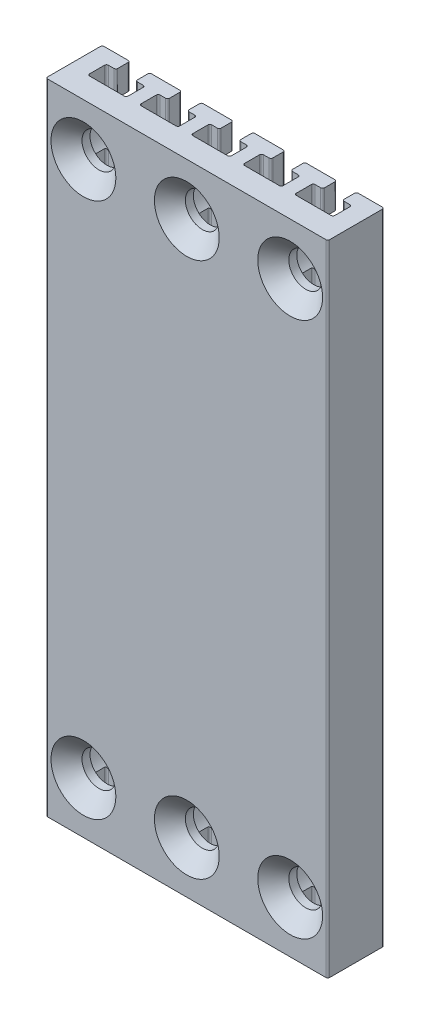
SolidWorks part; units mm, degrees
ref_plane "Plan de face" through (0, 0, 0) normal (0, 0, 1) x (1, 0, 0)
ref_plane "Plan de dessus" through (0, 0, 0) normal (0, 1, 0) x (1, 0, 0)
ref_plane "Plan de droite" through (0, 0, 0) normal (1, 0, 0) x (0, 0, -1)
sketch "Esquisse1" plane through (0, 0, 0) normal (0, 1, 0) x (1, 0, 0)
  line L0 (-11, 2.5) -> (-11, 6) construction
  line L1 (-15, 6) -> (-12.05, 6)
  line L2 (-15, 6) -> (-15, 0)
  line L3 (-15, 0) -> (15, 0)
  line L4 (15, 6) -> (15, 0)
  line L5 (-13.05, 2.5) -> (-8.95, 2.5)
  line L6 (-13.05, 2.5) -> (-13.05, 4.5)
  line L7 (-13.05, 4.5) -> (-12.05, 4.5)
  line L8 (-8.95, 2.5) -> (-8.95, 4.5)
  line L9 (-12.05, 4.5) -> (-12.05, 6)
  line L10 (-9.95, 4.5) -> (-9.95, 6)
  line L11 (-9.95, 6) -> (-6.55, 6)
  line L12 (-9.95, 4.5) -> (-8.95, 4.5)
  line L13 (-7.55, 2.5) -> (-3.45, 2.5)
  line L14 (-7.55, 2.5) -> (-7.55, 4.5)
  line L15 (-7.55, 4.5) -> (-6.55, 4.5)
  line L16 (-3.45, 2.5) -> (-3.45, 4.5)
  line L17 (-6.55, 4.5) -> (-6.55, 6)
  line L18 (-4.45, 4.5) -> (-4.45, 6)
  line L19 (-4.45, 4.5) -> (-3.45, 4.5)
  line L20 (-5.5, 2.5) -> (-5.5, 6) construction
  line L21 (-2.05, 2.5) -> (2.05, 2.5)
  line L22 (-2.05, 2.5) -> (-2.05, 4.5)
  line L23 (-2.05, 4.5) -> (-1.05, 4.5)
  line L24 (2.05, 2.5) -> (2.05, 4.5)
  line L25 (-1.05, 4.5) -> (-1.05, 6)
  line L26 (1.05, 4.5) -> (1.05, 6)
  line L27 (1.05, 4.5) -> (2.05, 4.5)
  line L28 (0, 2.5) -> (0, 6) construction
  line L29 (3.45, 2.5) -> (7.55, 2.5)
  line L30 (3.45, 2.5) -> (3.45, 4.5)
  line L31 (3.45, 4.5) -> (4.45, 4.5)
  line L32 (7.55, 2.5) -> (7.55, 4.5)
  line L33 (4.45, 4.5) -> (4.45, 6)
  line L34 (6.55, 4.5) -> (6.55, 6)
  line L35 (6.55, 4.5) -> (7.55, 4.5)
  line L36 (5.5, 2.5) -> (5.5, 6) construction
  line L37 (8.95, 2.5) -> (13.05, 2.5)
  line L38 (8.95, 2.5) -> (8.95, 4.5)
  line L39 (8.95, 4.5) -> (9.95, 4.5)
  line L40 (13.05, 2.5) -> (13.05, 4.5)
  line L41 (9.95, 4.5) -> (9.95, 6)
  line L42 (12.05, 4.5) -> (12.05, 6)
  line L43 (12.05, 4.5) -> (13.05, 4.5)
  line L44 (11, 2.5) -> (11, 6) construction
  line L45 (-4.45, 6) -> (-1.05, 6)
  line L46 (1.05, 6) -> (4.45, 6)
  line L47 (6.55, 6) -> (9.95, 6)
  line L48 (12.05, 6) -> (15, 6)
  dimension "D1" = 30
  dimension "D2" = 6
  dimension "D3" = 4.1
  dimension "D4" = 2
  dimension "D5" = 2.1
  dimension "D6" = 2.5
  dimension "D7" = 4
  dimension "D9" = 5.5
  dimension "D8" = 5
extrude "Boss.-Extru.1" add sketch "Esquisse1" along normal blind 68
fillet "Cassage d'angle rainures" radius 0.2 44 edges at (8.95, 34, -4.5) (3.45, 34, -4.5) (-2.05, 34, -4.5) (-7.55, 34, -4.5) (-13.05, 34, -4.5) (13.05, 34, -2.5) (7.55, 34, -2.5) (2.05, 34, -2.5) (-3.45, 34, -2.5) (-8.95, 34, -2.5) (8.95, 34, -2.5) (3.45, 34, -2.5) (-2.05, 34, -2.5) (-7.55, 34, -2.5) (-13.05, 34, -2.5) (13.05, 34, -4.5) (7.55, 34, -4.5) (2.05, 34, -4.5) (-3.45, 34, -4.5) (-8.95, 34, -4.5) (12.05, 34, -4.5) (9.95, 34, -4.5) (6.55, 34, -4.5) (4.45, 34, -4.5) (1.05, 34, -4.5) (-1.05, 34, -4.5) (-4.45, 34, -4.5) (-6.55, 34, -4.5) (-9.95, 34, -4.5) (-12.05, 34, -4.5) (15, 34, 0) (-15, 34, 0) (15, 34, -6) (12.05, 34, -6) (9.95, 34, -6) (6.55, 34, -6) (4.45, 34, -6) (1.05, 34, -6) (-1.05, 34, -6) (-4.45, 34, -6) (-6.55, 34, -6) (-9.95, 34, -6) (-12.05, 34, -6) (-15, 34, -6)
sketch "Esquisse2" plane through (0, 0, -6) normal (0, 0, -1) x (-1, 0, 0)
  line L0 (-9.75, 68) -> (-6.75, 68) construction
  circle A0 centre (-11, 62.5) radius 3
  circle A1 centre (0, 62.5) radius 3
  circle A2 centre (11, 62.5) radius 3
  circle A3 centre (0, 5.5) radius 3
  circle A4 centre (11, 5.5) radius 3
  circle A5 centre (-11, 5.5) radius 3
  dimension "D1" = 6
  dimension "D3" = 5.5
  dimension "D2" = 11
  dimension "D6" = 11
  dimension "D7" = 57
  dimension "D4" = 3
  dimension "D5" = 2
extrude "centrage rappels" cut sketch "Esquisse2" against normal up to surface (3.5 mm away)
hole_wizard "Fraisage pour vis à tête fraisée M33" positions "Esquisse9" profile "Esquisse8" countersink size "M3" standard "Iso"
sketch "Esquisse9" plane through (0, 0, 0) normal (0, 0, 1) x (1, 0, 0)
  point P0 (-11, 62.5)
sketch "Esquisse8" plane through (-11, 62.5, 0) normal (1, 0, 0) x (0, -1, 0)
  line L0 (0, 0) -> (0, 6)
  line L1 (0, 6) -> (1.8, 6)
  line L2 (1.8, 6) -> (1.8, 1.65)
  line L3 (1.8, 1.65) -> (3.45, 0)
  line L5 (3.45, 0) -> (0, 0)
  line L6 (-1.8, 1.65) -> (-3.45, 0) construction
  line L11 (0, -6.35) -> (0, 107.95) construction
  dimension "Diamètre du perçage jusqu'au prochain" = 3.6
  dimension "Profondeur du perçage jusqu'au prochain" = 6
  dimension "Diamètre du fraisage entrant" = 6.9
  dimension "Angle du fraisage entrant" = 90
pattern_linear "Répétition linéaire1" count 3 spacing 11 along (1, 0, 0) count 2 spacing 57 along (0, -1, 0) of "Fraisage pour vis à tête fraisée M33"
